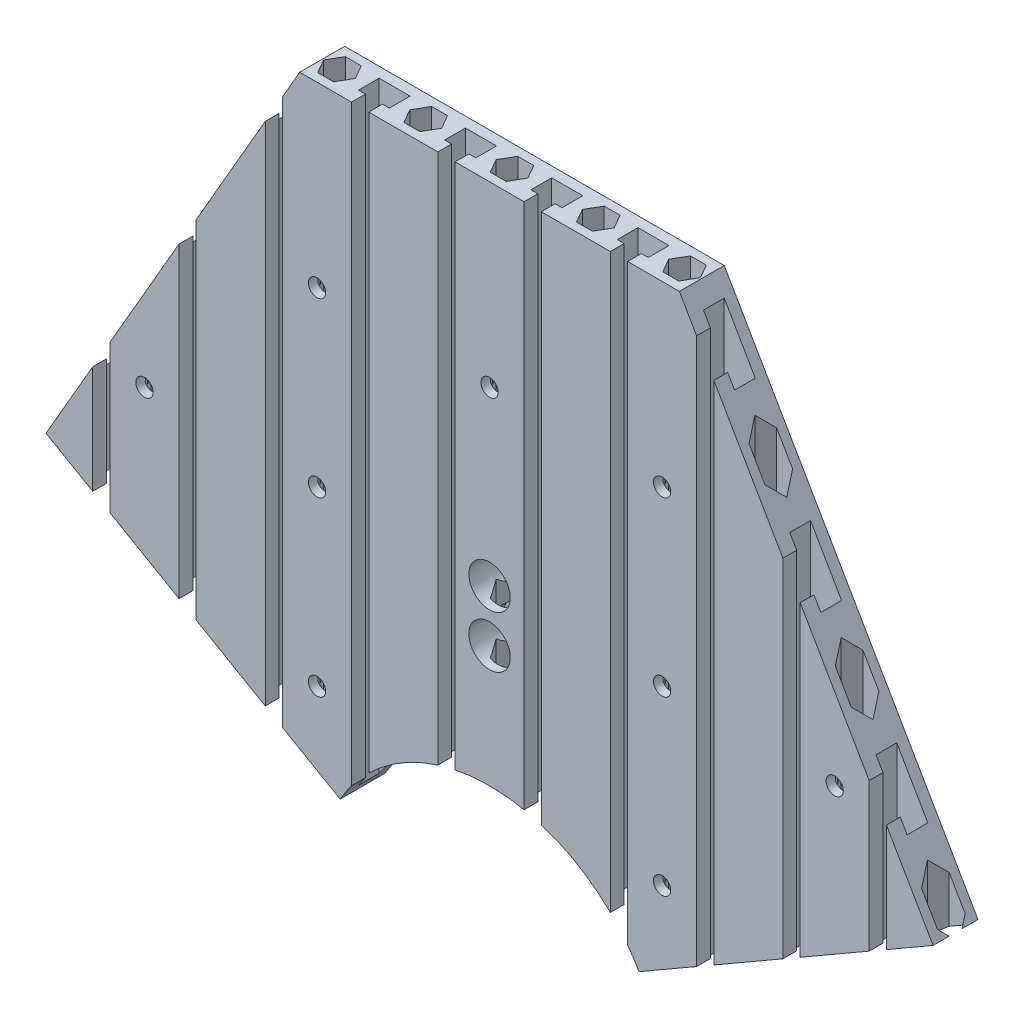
SolidWorks part; units mm, degrees
ref_plane "Plan de face" through (0, 0, 0) normal (0, 0, 1) x (1, 0, 0)
ref_plane "Plan de dessus" through (0, 0, 0) normal (0, 1, 0) x (1, 0, 0)
ref_plane "Plan de droite" through (0, 0, 0) normal (1, 0, 0) x (0, 0, -1)
sketch "Esquisse1" plane through (0, 0, 0) normal (0, 0, 1) x (1, 0, 0)
  line L6 (35.7636, 358.7862) -> (-423.8647, -437.3133) construction
  line L7 (-755.4678, -148.4209) -> (879.7592, -148.4209) construction
  line L8 (-46.1325, 376.7457) -> (415.4529, -422.7436) construction
  line L9 (257.0726, -148.4209) -> (-245.0999, 141.5085) construction
  line L10 (-257.0726, -148.4209) -> (263.2247, 151.9729) construction
  line L11 (-55, 201.5791) -> (55, 201.5791)
  line L12 (-147.0726, -148.4209) -> (147.0726, -148.4209)
  line L13 (147.0726, -148.4209) -> (202.0726, -53.1581)
  line L14 (202.0726, -53.1581) -> (55, 201.5791)
  line L15 (-147.0726, -148.4209) -> (-202.0726, -53.1581)
  line L16 (-202.0726, -53.1581) -> (-55, 201.5791)
  dimension "D1" = 60
  dimension "D2" = 60
  dimension "D3" = 110
  dimension "D4" = 350
  dimension "D5" = 60
  dimension "D6" = 60
  dimension "D7" = 110
  dimension "D8" = 110
extrude "Boss.-Extru.2" add sketch "Esquisse1" along normal blind 13
sketch "Esquisse3" plane through (0, 201.5791, 0) normal (0, 1, 0) x (1, 0, 0)
  line L0 (-12.5, 6.793) -> (-12.5, -19.2478) construction
  line L1 (-8, -3) -> (-17, -3)
  line L2 (-17, -3) -> (-17, -9)
  line L3 (-17, -9) -> (-15, -9)
  line L4 (-15, -9) -> (-15, -13)
  line L5 (55, -13) -> (-55, -13) construction
  line L6 (-10, -9) -> (-10, -13)
  line L7 (-8, -9) -> (-10, -9)
  line L8 (-8, -3) -> (-8, -9)
  line L9 (-15, -13) -> (-10, -13)
  point P2 (-12.5, -13)
  point P14 (-12.5, -3)
  dimension "D1" = 12.5
  dimension "D2" = 9
  dimension "D3" = 5
  dimension "D4" = 6
  dimension "D5" = 4
extrude "Enlèv. mat.-Extru.1" cut sketch "Esquisse3" against normal up to next
pattern_linear "Répétition linéaire1" count 8 spacing 25 along (1, 0, 0) of "Enlèv. mat.-Extru.1"
pattern_linear "Répétition linéaire2" count 7 spacing 25 along (-1, 0, 0) of "Enlèv. mat.-Extru.1"
sketch "certcleRotules" plane through (0, 0, 13) normal (0, 0, 1) x (1, 0, 0)
  circle A0 centre (0, 0) radius 157.5
  dimension "D1" = 315
sketch "Esquisse6" plane through (0, 0, 0) normal (0, 1, 0) x (1, 0, 0)
  line L0 (-157.5, -13) -> (157.5, -13) construction
  line L1 (0, 0) -> (-4.5, 0)
  line L2 (0, 0) -> (0, -13)
  line L3 (-2.5, -9) -> (-4.5, -9)
  line L4 (-4.5, 0) -> (-4.5, -9)
  line L7 (0, -13) -> (-2.5, -13)
  line L8 (-2.5, -9) -> (-2.5, -13)
  dimension "D1" = 4.5
  dimension "D2" = 2.5
  dimension "D3" = 4
revolve "Enlèvement de matière-Révolution1" cut sketch "Esquisse6" angle 360 about L2
pattern_linear "Répétition linéaire3" count 4 spacing 50 along (0, 1, 0) count 4 spacing 50 along (1, 0, 0) of "Enlèvement de matière-Révolution1"
pattern_linear "Répétition linéaire5" count 3 spacing 50 along (0, -1, 0) count 4 spacing 50 along (1, 0, 0) of "Enlèvement de matière-Révolution1"
pattern_linear "Répétition linéaire6" count 4 spacing 50 along (0, 1, 0) count 4 spacing 50 along (-1, 0, 0) of "Enlèvement de matière-Révolution1"
pattern_linear "Répétition linéaire7" count 3 spacing 50 along (0, -1, 0) count 4 spacing 50 along (-1, 0, 0) of "Enlèvement de matière-Révolution1"
sketch "Esquisse8" plane through (0, 0, 0) normal (0, 0, -1) x (-1, 0, 0)
  circle A0 centre (0, 100) radius 4.5 construction
  circle A1 centre (0, 100) radius 4.5
extrude "bouchonBarreauHaut" add sketch "Esquisse8" against normal blind 13
sketch "Esquisse7" plane through (0, 0, 0) normal (0, 0, -1) x (-1, 0, 0)
  line L1 (-6.5, 105.15) -> (6.5, 105.15)
  line L2 (-6.5, 105.15) -> (-6.5, 80.15)
  line L3 (-6.5, 80.15) -> (6.5, 80.15)
  line L4 (6.5, 105.15) -> (6.5, 80.15)
  line L5 (0, 7.15) -> (0, -7.15) construction
  dimension "D1" = 25
  dimension "D2" = 80.15
  dimension "D3" = 13
  dimension "D4" = 6.5
extrude "Boss.-Extru.4" add sketch "Esquisse7" along normal blind 5
sketch "4parties" plane through (0, 0, 0) normal (0, 0, 1) x (1, 0, 0)
  line L0 (257.0726, -148.4209) -> (-245.0999, 141.5085) construction
  line L2 (-43.3013, 25) -> (-128.5363, 74.2105)
  line L3 (-165, 11.0535) -> (-202.0726, -53.1581) construction
  line L4 (43.3013, 25) -> (128.5363, 74.2105)
  line L5 (202.0726, -53.1581) -> (165, 11.0535) construction
  line L6 (0, -50) -> (0, -148.4209)
  line L7 (-10, -148.4209) -> (10, -148.4209) construction
  line L8 (202.0726, -53.1581) -> (55, 201.5791) construction
  circle A0 centre (0, 0) radius 50
  dimension "D1" = 100
sketch "Esquisse9" plane through (0, 0, 0) normal (1, 0, 0) x (0, 0, -1)
  line L0 (5, 80.15) -> (0, 80.15) construction
  line L1 (5, 80.15) -> (5, 105.15) construction
  line L3 (5, 85.15) -> (5, 82.5)
  line L4 (5, 82.5) -> (-3, 82.5)
  line L6 (-3, -148.4209) -> (-3, 201.5791) construction
  line L7 (-13, 157.5) -> (-13, -157.5) construction
  line L8 (-3, 79.15) -> (-13, 79.15)
  line L9 (-3, 79.15) -> (-3, 82.5)
  line L10 (5, 85.15) -> (-13, 85.15)
  line L11 (-13, 79.15) -> (-13, 85.15)
  dimension "D1" = 5
  dimension "D2" = 2.65
  dimension "D3" = 6
revolve "Enlèvement de matière-Révolution2" cut sketch "Esquisse9" angle 360 about L10
pattern_linear "Répétition linéaire8" count 2 spacing 15 along (0, 1, 0) of "Enlèvement de matière-Révolution2"
pattern_circular "Répétition circulaire1" count 3 every 120 about axis through (0, 0, 0) along (0, 0, 1) of "Boss.-Extru.4", "Enlèvement de matière-Révolution2", "Répétition linéaire8"
sketch "Esquisse10" plane through (0, 0, 0) normal (1, 0, 0) x (0, 0, -1)
  line L0 (0, 201.5791) -> (0, -53.1581) construction
  line L1 (0, 77.5) -> (5, 77.5)
  line L2 (0, 77.5) -> (0, 72.5)
  line L3 (0, 72.5) -> (5, 72.5)
  line L4 (5, 77.5) -> (5, 72.5)
  line L5 (0, 50) -> (0, -50) construction
  line L6 (0, -72.5) -> (5, -72.5)
  line L7 (0, -72.5) -> (0, -77.5)
  line L8 (0, -77.5) -> (5, -77.5)
  line L9 (5, -72.5) -> (5, -77.5)
  line L10 (5, 80.15) -> (5, 105.15) construction
  line L11 (-9, 50) -> (0, 50) construction
  line L13 (-9, -100) -> (0, -100) construction
  point P16 (2.5, 72.5)
  point P19 (2.5, -72.5)
  dimension "D1" = 22.5
  dimension "D2" = 5
  dimension "D3" = 22.5
  dimension "D4" = 5
extrude "Boss.-Extru.6" add sketch "Esquisse10" along normal mid plane 250
chamfer "Chanfrein1" distance 5 angle 60 4 edges at (125, -75, -5) (-125, -75, -5) (-125, 75, -5) (125, 75, -5)
sketch "Esquisse11" plane through (0, 0, 13) normal (0, 0, 1) x (1, 0, 0)
  line L0 (-10, -148.4209) -> (-10, 201.5791) construction
  line L1 (-10, 23.5) -> (10, 23.5)
  line L2 (-10, 23.5) -> (-10, -23.5)
  line L3 (-10, -23.5) -> (10, -23.5)
  line L4 (10, 23.5) -> (10, -23.5)
  line L5 (10, -148.4209) -> (10, 201.5791) construction
  dimension "D1" = 47
  dimension "D2" = 23.5
extrude "Enlèv. mat.-Extru.2" cut sketch "Esquisse11" against normal blind 8.9
sketch "Esquisse13" plane through (-8, 0, 0) normal (-1, 0, 0) x (0, 0, 1)
  line L1 (4.1, -23.5) -> (11.1, -23.5)
  line L2 (4.1, -23.5) -> (4.1, -40)
  line L3 (4.1, -40) -> (6.1, -40)
  line L4 (11.1, -23.5) -> (11.1, -35)
  arc A0 (6.1, -40) -> (11.1, -35) centre (6.1, -35) ccw
  dimension "D2" = 5
  dimension "D1" = 16.5
  dimension "D3" = 7
extrude "Enlèv. mat.-Extru.3" cut sketch "Esquisse13" against normal up to surface (16 mm away)
sketch "Esquisse14" plane through (0, 0, 4.1) normal (0, 0, 1) x (1, 0, 0)
  line L0 (-8, 23.5) -> (-8, -40) construction
  line L1 (-3, -20) -> (3, -20)
  line L2 (-8, -25) -> (-8, -35)
  line L3 (-3, -40) -> (3, -40)
  line L4 (8, -25) -> (8, -35)
  line L5 (8, -40) -> (8, 23.5) construction
  line L6 (8, -40) -> (-8, -40) construction
  arc A0 (-8, -35) -> (-3, -40) centre (-3, -35) ccw
  arc A1 (3, -40) -> (8, -35) centre (3, -35) ccw
  arc A2 (3, -20) -> (8, -25) centre (3, -25) cw
  arc A3 (-3, -20) -> (-8, -25) centre (-3, -25) ccw
  point P16 (8, -20)
  point P19 (-8, -20)
  dimension "D3" = 5
  dimension "D1" = 20
extrude "Enlèv. mat.-Extru.4" cut sketch "Esquisse14" against normal up to next
mirror "Symétrie1" about plane through (0, 0, 0) normal (0, 1, 0) of "Enlèv. mat.-Extru.4", "Enlèv. mat.-Extru.3"
sketch "Esquisse15" plane through (0, 0, 0) normal (0, 0, -1) x (-1, 0, 0)
  circle A0 centre (-50, 0) radius 4.5 construction
  circle A1 centre (0, -50) radius 4.5 construction
  circle A2 centre (50, 0) radius 4.5 construction
  circle A3 centre (0, 50) radius 4.5 construction
  circle A4 centre (-50, 0) radius 4.5
  circle A5 centre (0, -50) radius 4.5
  circle A6 centre (50, 0) radius 4.5
  circle A7 centre (0, 50) radius 4.5
extrude "boucheTrousCEntre" add sketch "Esquisse15" against normal up to surface (13 mm away)
sketch "Esquisse16" plane through (0, -148.4209, 0) normal (0, -1, 0) x (1, 0, 0)
  line L0 (0, -9.9) -> (0, 9.9) construction
  line L1 (-2.3094, 2.5) -> (2.3094, 2.5)
  line L2 (2.3094, 2.5) -> (4.6188, 6.5)
  line L3 (4.6188, 6.5) -> (2.3094, 10.5)
  line L4 (2.3094, 10.5) -> (-2.3094, 10.5)
  line L5 (-2.3094, 10.5) -> (-4.6188, 6.5)
  line L6 (-4.6188, 6.5) -> (-2.3094, 2.5)
  line L8 (-10, 13) -> (10, 13) construction
  circle A0 centre (0, 6.5) radius 4 construction
  dimension "D1" = 6.5
  dimension "D2" = 8
extrude "Enlèv. mat.-Extru.5" cut sketch "Esquisse16" against normal through all
pattern_linear "Répétition linéaire9" count 8 spacing 25 along (1, 0, 0) of "Enlèv. mat.-Extru.5"
pattern_linear "Répétition linéaire10" count 8 spacing 25 along (-1, 0, 0) of "Enlèv. mat.-Extru.5"
sketch "Esquisse17" plane through (0, 0, 0) normal (0, 0, -1) x (-1, 0, 0)
  line L0 (0, -50) -> (0, -148.4209) construction
  line L1 (147.0726, -148.4209) -> (-147.0726, -148.4209) construction
  circle A0 centre (0, -123.4209) radius 5
  dimension "D1" = 10
  dimension "D2" = 25
extrude "Enlèv. mat.-Extru.6" cut sketch "Esquisse17" against normal up to vertex
fillet "chanfrein" radius 2 1 edges at (-5, -123.4209, 0)
pattern_linear "Répétition linéaire11" count 9 spacing 25 along (-1, 0, 0) count 13 spacing 25 along (0, 1, 0) of "Enlèv. mat.-Extru.6", "chanfrein"
mirror "Symétrie3" about plane through (0, 0, 0) normal (1, 0, 0) of "Répétition linéaire11"
sketch "Esquisse18" plane through (0, 0, 0) normal (0, 0, -1) x (-1, 0, 0)
  line L0 (-43.3013, 25) -> (-128.5363, 74.2105) construction
  line L1 (43.3013, 25) -> (128.5363, 74.2105) construction
  line L2 (43.3013, 25) -> (128.5363, 74.2105)
  line L3 (-43.3013, 25) -> (-128.5363, 74.2105)
  line L6 (202.0726, -53.1581) -> (55, 201.5791)
  line L7 (55, 201.5791) -> (-55, 201.5791)
  line L8 (-55, 201.5791) -> (-202.0726, -53.1581)
  line L9 (-202.0726, -53.1581) -> (-147.0726, -148.4209)
  line L10 (-147.0726, -148.4209) -> (147.0726, -148.4209)
  line L11 (147.0726, -148.4209) -> (202.0726, -53.1581)
  line L12 (202.0726, -53.1581) -> (128.5363, 74.2105)
  line L14 (-128.5363, 74.2105) -> (-202.0726, -53.1581)
  line L15 (-202.0726, -53.1581) -> (-147.0726, -148.4209)
  line L16 (-147.0726, -148.4209) -> (147.0726, -148.4209)
  line L17 (147.0726, -148.4209) -> (202.0726, -53.1581)
  circle A0 centre (0, 0) radius 50 construction
  arc A1 (43.3013, 25) -> (-43.3013, 25) centre (0, 0) ccw
  dimension "D1" = 0
extrude "Enlèv. mat.-Extru.8" cut sketch "Esquisse18" against normal through all both and the other way through all
ref_plane "Plan1" through (0, 50, 0) normal (0, -1, 0) x (-1, 0, 0)
sketch "Esquisse19" plane through (0, 50, 0) normal (0, -1, 0) x (-1, 0, 0)
  line L0 (0, 9.9) -> (0, -9.9) construction
  line L1 (-2.3094, -2.5) -> (2.3094, -2.5) construction
  circle A0 centre (0, -6.5) radius 5
  dimension "D1" = 10
  dimension "D3" = 4
extrude "Enlèv. mat.-Extru.10" cut sketch "Esquisse19" along normal up to surface
sketch "Esquisse20" plane through (0, 50, 0) normal (0, -1, 0) x (1, 0, 0)
  arc A0 (0, 11.5) -> (0, 1.5) centre (0, 6.5) ccw construction
  arc A1 (0, 11.5) -> (0, 1.5) centre (0, 6.5) ccw
  arc A2 (0, 1.5) -> (0, 11.5) centre (0, 6.5) ccw construction
  arc A3 (0, 1.5) -> (0, 11.5) centre (0, 6.5) ccw
extrude "Enlèv. mat.-Extru.11" cut sketch "Esquisse20" against normal blind 6
chamfer "Chanfrein2" distance 0.5 angle 45 6 edges at (3.4641, 56, 4.5) (3.4641, 56, 8.5) (0, 56, 10.5) (-3.4641, 56, 8.5) (-3.4641, 56, 4.5) (0, 56, 2.5)
ref_plane "Plan2" through (0, 55.0684, 0) normal (0, 1, 0) x (1, 0, 0)
sketch "Esquisse21" plane through (0, 55.0684, 0) normal (0, 1, 0) x (1, 0, 0)
  line L0 (102.3094, -10.5) -> (97.6906, -10.5) construction
  line L2 (108, -9) -> (108, -3) construction
  circle A0 centre (100, -6.5) radius 5
  circle A1 centre (-100, -6.5) radius 5
  dimension "D1" = 10
  dimension "D2" = 4
  dimension "D3" = 8
  dimension "D5" = 200
  dimension "D4" = 2
extrude "Enlèv. mat.-Extru.12" cut sketch "Esquisse21" along normal blind 6 and the other way through all
sketch "Esquisse25" plane through (0, 55.0684, 0) normal (0, 1, 0) x (1, 0, 0)
  circle A0 centre (100, -6.5) radius 5
  circle A1 centre (100, -6.5) radius 5 construction
  circle A2 centre (-100, -6.5) radius 5
  dimension "D2" = 200
  dimension "D1" = 2
extrude "Enlèv. mat.-Extru.13" cut sketch "Esquisse25" along normal blind 12
chamfer "Chanfrein3" distance 0.5 angle 45 12 edges at (103.4641, 67.0684, 4.5) (103.4641, 67.0684, 8.5) (100, 67.0684, 10.5) (96.5359, 67.0684, 8.5) (96.5359, 67.0684, 4.5) (100, 67.0684, 2.5) (-96.5359, 67.0684, 4.5) (-100, 67.0684, 2.5) (-96.5359, 67.0684, 8.5) (-103.4641, 67.0684, 4.5) (-103.4641, 67.0684, 8.5) (-100, 67.0684, 10.5)
